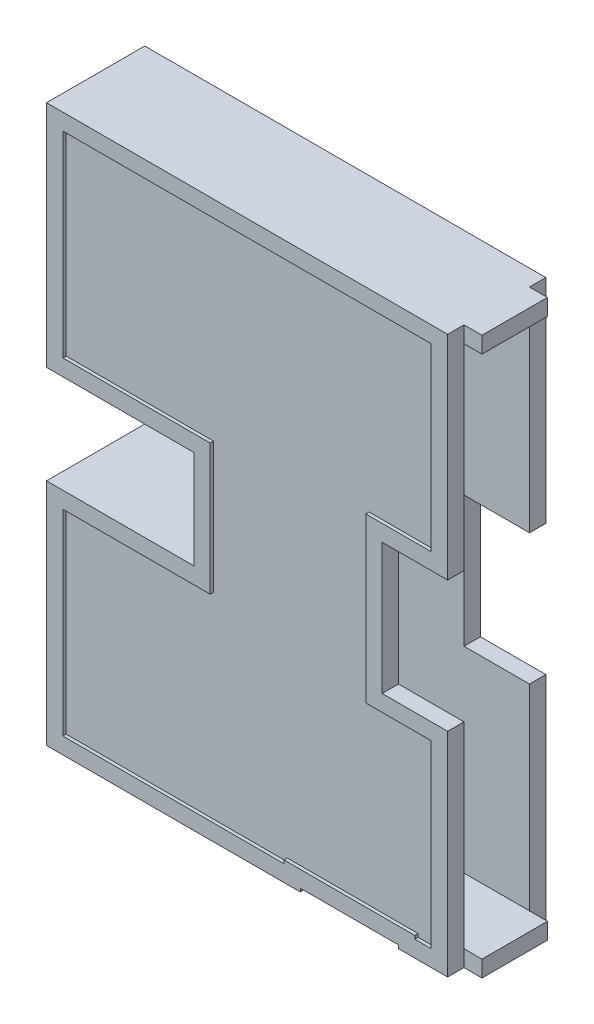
SolidWorks part; units mm, degrees
ref_plane "Plan de face" through (0, 0, 0) normal (0, 0, 1) x (1, 0, 0)
ref_plane "Plan de dessus" through (0, 0, 0) normal (0, 1, 0) x (1, 0, 0)
ref_plane "Plan de droite" through (0, 0, 0) normal (1, 0, 0) x (0, 0, -1)
sketch "Esquisse1" plane through (0, 0, 0) normal (0, 0, 1) x (1, 0, 0)
  line L0 (0, 0) -> (77.5, 0)
  line L1 (77.5, 0) -> (77.5, 1)
  line L2 (77.5, 1) -> (107.5, 1)
  line L3 (107.5, 1) -> (107.5, 0)
  line L4 (107.5, 0) -> (128, 0)
  line L6 (128, 0) -> (128, 5)
  line L8 (128, 5) -> (122.5, 5)
  line L9 (122.5, 5) -> (122.5, 65)
  line L10 (122.5, 65) -> (102.5, 65)
  line L11 (102.5, 65) -> (102.5, 105)
  line L12 (102.5, 105) -> (122.5, 105)
  line L13 (122.5, 105) -> (122.5, 165)
  line L14 (122.5, 165) -> (128, 165)
  line L16 (128, 165) -> (128, 170)
  line L18 (128, 170) -> (0, 170)
  line L19 (0, 170) -> (0, 100)
  line L20 (0, 100) -> (45, 100)
  line L21 (45, 100) -> (45, 70)
  line L24 (45, 70) -> (0, 70)
  line L25 (0, 70) -> (0, 0)
  dimension "D1" = 70
  dimension "D2" = 30
  dimension "D3" = 70
  dimension "D4" = 128
  dimension "D5" = 5
  dimension "D6" = 60
  dimension "D7" = 40
  dimension "D8" = 60
  dimension "D9" = 5
  dimension "D10" = 45
  dimension "D11" = 30
  dimension "D12" = 1
  dimension "D13" = 1
  dimension "D14" = 20
  dimension "D15" = 20
  dimension "D16" = 5.5
  dimension "D17" = 77.5
  dimension "D18" = 20.5
extrude "Boss.-Extru.1" add sketch "Esquisse1" along normal blind 15
sketch "Esquisse2" plane through (0, 0, 15) normal (0, 0, 1) x (1, 0, 0)
  line L2 (128, 165) -> (0, 165)
  line L3 (117.5, 165) -> (5, 165)
  line L20 (0, 5) -> (77.5, 5)
  line L21 (5, 5) -> (72.5, 5)
  line L24 (112.5, 6) -> (112.5, 5)
  line L25 (112.5, 6) -> (112.5, 5)
  line L26 (112.5, 5) -> (117.5, 5)
  line L27 (112.5, 5) -> (117.5, 5)
  line L73 (5, 65) -> (5, 5)
  line L74 (5, 5) -> (72.5, 5)
  line L75 (72.5, 5) -> (72.5, 6)
  line L76 (72.5, 6) -> (112.5, 6)
  line L77 (117.5, 5) -> (117.5, 60)
  line L78 (117.5, 60) -> (97.5, 60)
  line L79 (97.5, 60) -> (97.5, 110)
  line L80 (97.5, 110) -> (117.5, 110)
  line L81 (117.5, 110) -> (117.5, 165)
  line L82 (117.5, 165) -> (5, 165)
  line L83 (5, 165) -> (5, 105)
  line L84 (5, 105) -> (50, 105)
  line L85 (50, 105) -> (50, 65)
  line L86 (50, 65) -> (5, 65)
  line L87 (5, 65) -> (5, 5)
  line L88 (5, 5) -> (72.5, 5)
  line L89 (72.5, 5) -> (72.5, 6)
  line L90 (72.5, 6) -> (112.5, 6)
  line L91 (117.5, 5) -> (117.5, 60)
  line L92 (117.5, 60) -> (97.5, 60)
  line L93 (97.5, 60) -> (97.5, 110)
  line L94 (97.5, 110) -> (117.5, 110)
  line L95 (117.5, 110) -> (117.5, 165)
  line L96 (117.5, 165) -> (5, 165)
  line L97 (5, 165) -> (5, 105)
  line L98 (5, 105) -> (50, 105)
  line L99 (50, 105) -> (50, 65)
  line L100 (50, 65) -> (5, 65)
  dimension "D1" = 5
  dimension "D7" = 5
  dimension "D12" = 5
extrude "Enlèv. mat.-Extru.1" cut sketch "Esquisse2" against normal blind 1 contours L99 L100 L87 L21 L89 L90 L91 L92 L93 L94 L95 L3 L97 L98
mirror "Symétrie1" about plane through (0, 0, 0) normal (0, 0, 1) of "Enlèv. mat.-Extru.1", "Boss.-Extru.1"
sketch "Esquisse3" plane through (128, 0, 0) normal (1, 0, 0) x (0, 0, -1)
  line L0 (15, 5) -> (15, 65) construction
  line L1 (10, 5) -> (-10, 5)
  line L2 (10, 5) -> (10, 165)
  line L3 (10, 165) -> (-10, 165)
  line L4 (-10, 5) -> (-10, 165)
  line L5 (-15, 170) -> (15, 170) construction
  line L6 (-15, 0) -> (15, 0) construction
  point P6 (0, 170)
  dimension "D1" = 20
  dimension "D2" = 5
  dimension "D3" = 5
  dimension "D4" = 5
extrude "Enlèv. mat.-Extru.2" cut sketch "Esquisse3" against normal offset from surface (78 mm away) 5
sketch "Esquisse4" plane through (50, 0, 0) normal (1, 0, 0) x (0, 0, -1)
  line L1 (-10, 165) -> (10, 165)
  line L2 (-10, 165) -> (-10, 105)
  line L3 (-10, 105) -> (10, 105)
  line L4 (10, 165) -> (10, 105)
  line L5 (-10, 5) -> (10, 5)
  line L6 (-10, 5) -> (-10, 65)
  line L7 (-10, 65) -> (10, 65)
  line L8 (10, 5) -> (10, 65)
  dimension "D1" = 60
extrude "Enlèv. mat.-Extru.3" cut sketch "Esquisse4" against normal offset from surface (45 mm away) 5
sketch "Esquisse5" plane through (0, 0, 0) normal (0, -1, 0) x (1, 0, 0)
  line L1 (122.5, 15) -> (128, 15)
  line L2 (122.5, 15) -> (122.5, 10)
  line L3 (122.5, 10) -> (128, 10)
  line L4 (128, 15) -> (128, 10)
  line L5 (128, 15) -> (128, -15) construction
  line L6 (107.5, 15) -> (128, 15) construction
  line L7 (128, -15) -> (122.5, -15)
  line L8 (128, -15) -> (128, -10)
  line L9 (128, -10) -> (122.5, -10)
  line L10 (122.5, -15) -> (122.5, -10)
  line L11 (122.5, 15) -> (122.5, 10) construction
  dimension "D1" = 5
  dimension "D2" = 5
extrude "Enlèv. mat.-Extru.4" cut sketch "Esquisse5" against normal through all
